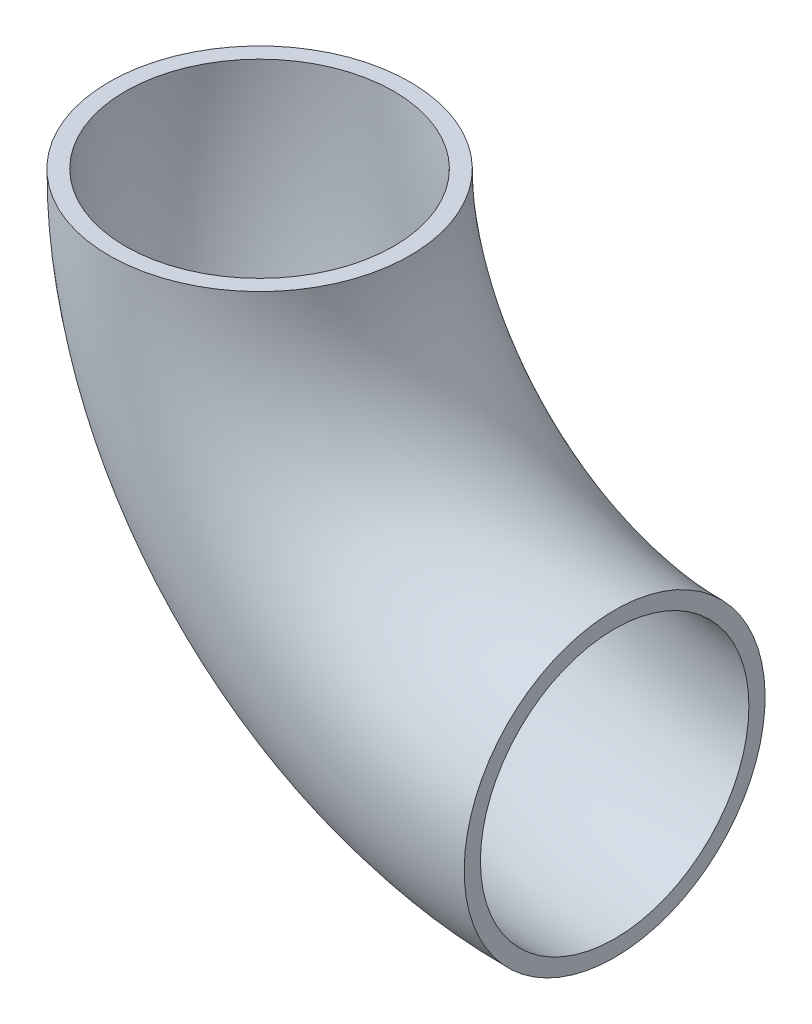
SolidWorks part; units mm, degrees
ref_plane "Plan de face" through (0, 0, 0) normal (0, 0, 1) x (1, 0, 0)
ref_plane "Plan de dessus" through (0, 0, 0) normal (0, 1, 0) x (1, 0, 0)
ref_plane "Plan de droite" through (0, 0, 0) normal (1, 0, 0) x (0, 0, -1)
sketch "Esquisse1" plane through (0, 0, 0) normal (0, 0, 1) x (1, 0, 0)
  line L0 (475.85, -358) -> (524.15, -358) construction
  arc A0 (500, -358) -> (557, -415) centre (557, -358) ccw
  dimension "D1" = 57
  dimension "D2" = 90
sketch "Esquisse2" plane through (0, -358, 0) normal (0, -1, 0) x (1, 0, 0)
  circle A0 centre (500, 0) radius 24.15 construction
  circle A1 centre (500, 0) radius 24.15
sweep "Balayage-Mince1" add profiles "Esquisse2" path "Esquisse1" parameters "D1"=2.6
